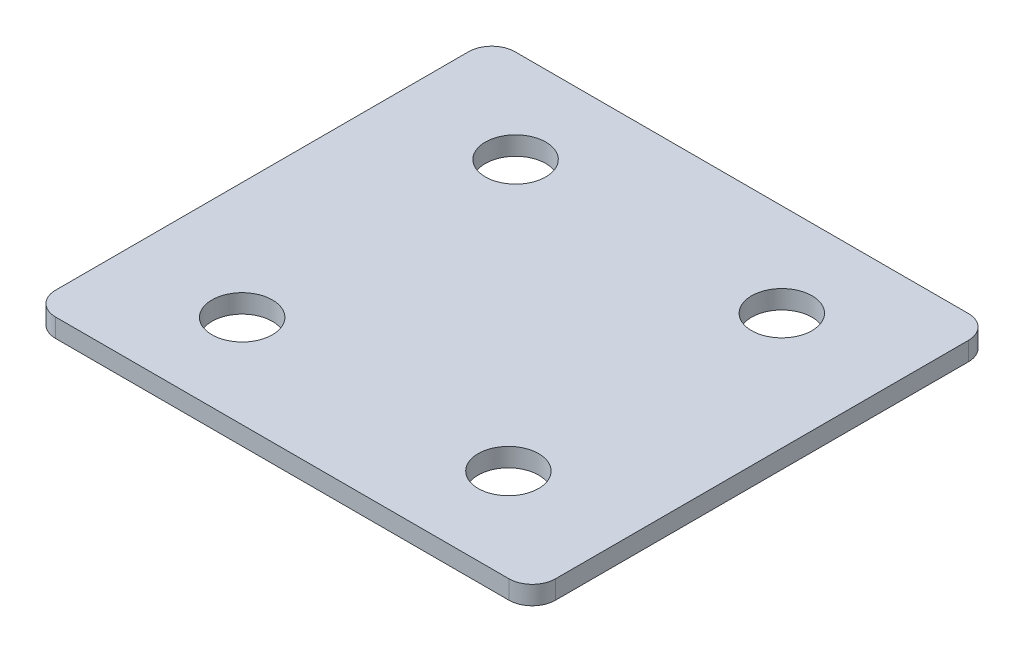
SolidWorks part; units mm, degrees
ref_plane "Front Plane" through (0, 0, 0) normal (0, 0, 1) x (1, 0, 0)
ref_plane "Top Plane" through (0, 0, 0) normal (0, 1, 0) x (1, 0, 0)
ref_plane "Right Plane" through (0, 0, 0) normal (1, 0, 0) x (0, 0, -1)
sketch "Sketch1" plane through (0, 0, 0) normal (0, 1, 0) x (1, 0, 0)
  line L1 (-10, 0) -> (-205, 0)
  line L2 (0, 10) -> (0, 187.59)
  line L3 (-10, 197.59) -> (-205, 197.59)
  line L4 (-215, 10) -> (-215, 187.59)
  arc A0 (-205, 0) -> (-215, 10) centre (-205, 10) cw
  arc A1 (0, 187.59) -> (-10, 197.59) centre (-10, 187.59) ccw
  arc A2 (-205, 197.59) -> (-215, 187.59) centre (-205, 187.59) ccw
  arc A3 (-10, 0) -> (0, 10) centre (-10, 10) ccw
  point P7 (-215, 0)
  point P10 (0, 197.59)
  point P13 (-215, 197.59)
  point P16 (0, 0)
  dimension "D3" = 10
  dimension "D1" = 197.59
  dimension "D2" = 215
base flange "Base-Flange1" sketch "Sketch1" thickness 8 reverse thickness direction no parameters "D1"=0.7366
ref_plane "Plane1" through (-107.5, 0, 0) normal (-1, 0, 0) x (0, 0, 1)
sketch "Sketch7" plane through (0, -8, 0) normal (0, -1, 0) x (1, 0, 0)
  circle A0 centre (-50.25, -157.5858) radius 13
  circle A1 centre (-50.25, -40) radius 13
  circle A2 centre (-164.75, -40) radius 13
  circle A3 centre (-164.75, -157.5858) radius 13
extrude "Cut-Extrude1" cut sketch "Sketch7" against normal blind 10
sketch "Bend-Lines1" [suppressed] plane through (0, 0, 0) normal (0, 1, 0) x (1, 0, 0)
sketch "Bounding-Box1" [suppressed] plane through (0, 0, 0) normal (0, 1, 0) x (1, 0, 0)
sheet metal parameters "Sheet-Metal1" thickness 8 parameters "D1"=0.7366
flat pattern "Flat-Pattern1"
sketch "Bend-Lines2" plane through (0, 0, 0) normal (0, 1, 0) x (1, 0, 0)
sketch3d "Bounding-Box2" [suppressed]
  line L0 (10, 187.59, 0) -> (-205, 187.59, 0) construction
  line L1 (10, -10, 0) -> (-205, -10, 0) construction
  line L2 (10, 187.59, 0) -> (10, -10, 0) construction
  line L3 (-205, 187.59, 0) -> (-205, -10, 0) construction
sheet metal parameters "Sheet-Metal2" thickness 8 parameters "D1"=0.7366
flat pattern "Flat-Pattern1"
sketch "Bend-Lines2" plane through (0, 0, 0) normal (0, 1, 0) x (1, 0, 0)
sketch3d "Bounding-Box2" [suppressed]
  line L0 (-10, 187.59, 0) -> (205, 187.59, 0) construction
  line L1 (-10, -10, 0) -> (205, -10, 0) construction
  line L2 (-10, 187.59, 0) -> (-10, -10, 0) construction
  line L3 (205, 187.59, 0) -> (205, -10, 0) construction
